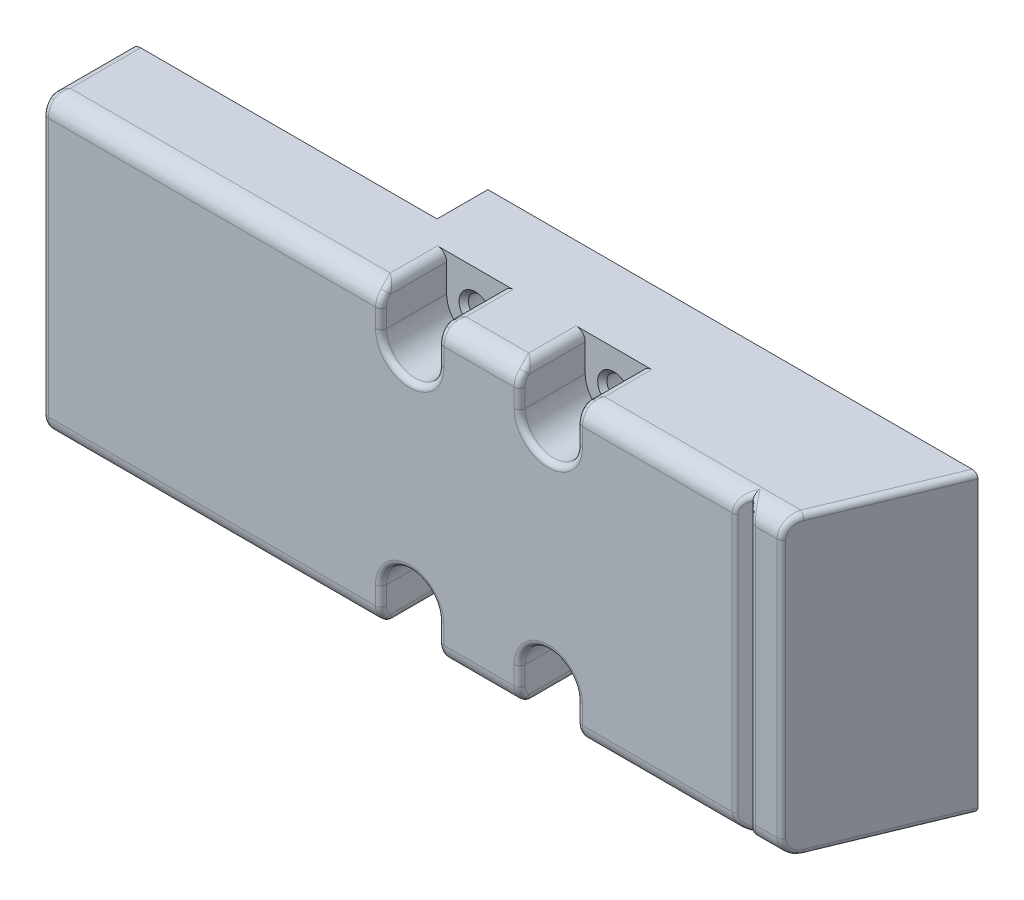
SolidWorks part; units mm, degrees
ref_plane "Front Plane" through (0, 0, 0) normal (0, 0, 1) x (1, 0, 0)
ref_plane "Top Plane" through (0, 0, 0) normal (0, 1, 0) x (1, 0, 0)
ref_plane "Right Plane" through (0, 0, 0) normal (1, 0, 0) x (0, 0, -1)
sketch "Sketch1" plane through (0, 0, 0) normal (0, 0, 1) x (1, 0, 0)
  line L0 (25.86, 8.5) -> (25.86, -8.5) construction
  line L3 (-49.73, -7.875) -> (-49.73, -11.225) construction
  line L4 (-42.14, 8.5) -> (25.86, 8.5) construction
  line L5 (25.86, 8.5) -> (25.86, -8.5) construction
  line L18 (25.86, -8.5) -> (-42.14, -8.5) construction
  line L19 (-42.14, 8.5) -> (25.86, 8.5) construction
  line L20 (25.86, 8.5) -> (25.86, -8.5) construction
  line L21 (25.86, -8.5) -> (-42.14, -8.5) construction
  line L22 (-49.72, 8.51) -> (25.87, 8.51)
  line L23 (25.87, 8.51) -> (25.87, -8.51)
  line L24 (25.87, -8.51) -> (-49.72, -8.51)
  line L25 (25.87, -8.51) -> (-42.14, -8.51) construction
  line L40 (-42.14, 8.51) -> (25.87, 8.51) construction
  line L41 (-49.72, 8.51) -> (-49.72, 16)
  line L127 (-33.5059, 0) -> (-3.7253, 0) construction
  line L134 (-49.72, -16) -> (28.36, -16)
  line L135 (-49.72, -16) -> (-49.72, -8.51)
  line L136 (-49.72, 16) -> (28.36, 16)
  line L137 (28.36, -16) -> (28.36, 16)
  line L138 (-49.72, -16) -> (28.36, 16) construction
  line L139 (-49.72, 16) -> (28.36, -16) construction
  point P6 (-10.68, 0)
extrude "Boss-Extrude1" add sketch "Sketch1" against normal up to surface (7.5 mm away)
sketch "Sketch3" plane through (0, 0, -7.6) normal (0, -1, 0) x (-1, 0, 0)
  line L0 (49.72, -0.1) -> (49.72, -7.6) construction
  line L1 (-28.36, -7.6) -> (49.72, -7.6)
  line L2 (-28.36, -7.6) -> (-28.36, -9.7)
  line L3 (-28.36, -9.7) -> (49.72, -9.7)
  line L4 (49.72, -7.6) -> (49.72, -9.7)
  dimension "D1" = 9.6
extrude "Boss-Extrude2" add sketch "Sketch3" against normal up to surface and the other way up to surface
sketch "Sketch8" plane through (0, 0, 2.1) normal (0, 0, 1) x (1, 0, 0)
  line L0 (-33.5059, 0) -> (-3.7253, 0) construction
  line L1 (28.36, -16) -> (-14.5, -16)
  line L2 (28.36, -16) -> (28.36, -16.5)
  line L3 (28.36, -16.5) -> (-14.5, -16.5)
  line L4 (-14.5, -16) -> (-14.5, -16.5)
  line L5 (-10, 12) -> (5, 12) construction
  line L6 (-10, 12) -> (-10, -12) construction
  line L7 (-10, -12) -> (5, -12) construction
  line L8 (5, 12) -> (5, -12) construction
  line L9 (-10, 12) -> (5, -12) construction
  line L10 (-10, -12) -> (5, 12) construction
  line L11 (0, 0) -> (5, 0) construction
  line L12 (28.36, 16) -> (28.36, 16.5)
  line L13 (28.36, 16) -> (-14.5, 16)
  line L14 (-14.5, 16) -> (-14.5, 16.5)
  line L15 (28.36, 16.5) -> (-14.5, 16.5)
  circle A0 centre (5, -12) radius 2.5 construction
  circle A1 centre (5, -12) radius 1.25 construction
  circle A2 centre (-10, -12) radius 1.25 construction
  circle A3 centre (5, 12) radius 1.25 construction
  circle A4 centre (-10, 12) radius 1.25 construction
  point P5 (-2.5, 0)
  dimension "D2" = 5
  dimension "D7" = 2.5
  dimension "D1" = 24
  dimension "D3" = 5
  dimension "D4" = 15
  dimension "D5" = 4.5
  dimension "D6" = 4.5
sketch "Sketch9" plane through (0, 0, 2.1) normal (0, 0, 1) x (1, 0, 0)
  circle A0 centre (-10, -12) radius 1.25 construction
  circle A1 centre (5, -12) radius 1.25 construction
  circle A2 centre (-10, 12) radius 1.25 construction
  circle A3 centre (5, 12) radius 1.25 construction
  circle A4 centre (-10, -12) radius 1.25
  circle A5 centre (5, -12) radius 1.25
  circle A6 centre (-10, 12) radius 1.25
  circle A7 centre (5, 12) radius 1.25
extrude "Cut-Extrude4" cut sketch "Sketch9" against normal through all
sketch "Sketch10" plane through (0, 0, -7.5) normal (0, 0, -1) x (-1, 0, 0)
  line L0 (-28.36, -16) -> (-28.36, 16) construction
  line L1 (-28.36, -16) -> (16.64, -16)
  line L2 (-28.36, -16) -> (-28.36, 16)
  line L3 (-28.36, 16) -> (16.64, 16)
  line L4 (16.64, -16) -> (16.64, -8.51)
  line L5 (-25.87, -8.51) -> (-25.87, 8.51) construction
  line L7 (-25.87, -8.51) -> (-25.87, 8.51)
  line L8 (16.64, -8.51) -> (-25.87, -8.51)
  line L10 (-25.87, 8.51) -> (16.64, 8.51)
  line L11 (16.64, 8.51) -> (16.64, 16)
  line L12 (49.72, -16) -> (-28.36, -16) construction
  line L13 (-28.36, 16) -> (49.72, 16) construction
  line L14 (-25.87, 8.51) -> (49.72, 8.51) construction
  line L15 (49.72, -8.51) -> (-25.87, -8.51) construction
  circle A1 centre (10, 12) radius 1.25 construction
  circle A2 centre (-5, 12) radius 1.25 construction
  circle A3 centre (10, -12) radius 1.25 construction
  circle A4 centre (-5, -12) radius 1.25 construction
  circle A5 centre (10, 12) radius 1.25
  circle A6 centre (-5, 12) radius 1.25
  circle A7 centre (10, -12) radius 1.25
  circle A8 centre (-5, -12) radius 1.25
  dimension "D1" = 45
extrude "Boss-Extrude4" add sketch "Sketch10" along normal offset from surface (5.5 mm away) 5.5
ref_plane "Plane1" through (0, 0, -15.5) normal (0, 0, -1) x (-1, 0, 0)
sketch "Sketch25" plane through (0, 16, 0) normal (0, 1, 0) x (1, 0, 0)
  line L0 (28.36, 13) -> (36.4146, 13)
  line L1 (36.4146, 13) -> (30.16, -2.1)
  line L2 (30.16, -2.1) -> (28.36, -2.1)
  line L4 (28.36, 13) -> (28.36, -2.1) construction
  line L5 (28.36, 13) -> (28.36, -2.1)
  dimension "D1" = 1.8
  dimension "D2" = 22.5
extrude "Boss-Extrude5" add sketch "Sketch25" against normal up to surface (32 mm away)
fillet "Fillet13" radius 2 2 edges at (-9.78, -16, 2.1) (-9.78, 16, 2.1)
sketch "Sketch11" plane through (0, 0, 2.1) normal (0, 0, 1) x (1, 0, 0)
  circle A0 centre (5, -12) radius 3.1
  circle A1 centre (-10, -12) radius 3.1
  circle A2 centre (5, 12) radius 3.1
  circle A3 centre (-10, 12) radius 3.1
  dimension "D1" = 6.2
extrude "Cut-Extrude5" cut sketch "Sketch11" against normal offset from surface (7.1 mm away) 10.5
sketch "Sketch16" plane through (0, 0, 2.1) normal (0, 0, 1) x (1, 0, 0)
  line L0 (-10, 12) -> (-6.9, 12) construction
  line L1 (-13.1, 12) -> (-6.9, 12)
  line L2 (-13.1, 12) -> (-13.1, 22)
  line L3 (-13.1, 22) -> (-6.9, 22)
  line L4 (-6.9, 12) -> (-6.9, 22)
  line L5 (1.9, 12) -> (8.1, 12)
  line L6 (1.9, 12) -> (1.9, 22)
  line L7 (1.9, 22) -> (8.1, 22)
  line L8 (8.1, 12) -> (8.1, 22)
  line L9 (-13.1, -12) -> (-6.9, -12)
  line L10 (-13.1, -12) -> (-13.1, -22)
  line L11 (-13.1, -22) -> (-6.9, -22)
  line L12 (-6.9, -12) -> (-6.9, -22)
  line L13 (1.9, -12) -> (8.1, -12)
  line L14 (1.9, -12) -> (1.9, -22)
  line L15 (1.9, -22) -> (8.1, -22)
  line L16 (8.1, -12) -> (8.1, -22)
  line L17 (-10, -12) -> (-6.9, -12) construction
  circle A0 centre (-10, 12) radius 3.1 construction
  circle A1 centre (-10, 12) radius 3.1 construction
  circle A2 centre (5, 12) radius 3.1 construction
  circle A3 centre (-10, -12) radius 3.1 construction
  circle A4 centre (-10, -12) radius 3.1 construction
  circle A8 centre (5, 12) radius 3.1 construction
  circle A9 centre (5, 12) radius 3.1 construction
  circle A11 centre (5, -12) radius 3.1 construction
  circle A12 centre (5, -12) radius 3.1 construction
  point P12 (1.9, 12)
  point P13 (8.1, 12)
  point P29 (8.1, -12)
  point P37 (1.9, -12)
  dimension "D1" = 10
extrude "Cut-Extrude8" cut sketch "Sketch16" against normal up to surface (7.1 mm away)
sketch "Sketch17" plane through (0, 0, -13) normal (0, 0, -1) x (-1, 0, 0)
  line L0 (16.64, -8.51) -> (16.64, 8.51)
  line L9 (-36.4146, 16) -> (-36.4146, -16)
  line L10 (-36.4146, 16) -> (-36.4146, -16)
  line L13 (-25.87, 8.51) -> (16.64, 8.51)
  line L14 (16.64, 8.51) -> (16.64, 16)
  line L15 (16.64, 16) -> (-36.4146, 16)
  line L17 (-36.4146, -16) -> (16.64, -16)
  line L18 (16.64, -16) -> (16.64, -8.51)
  line L19 (16.64, -8.51) -> (-25.87, -8.51)
  line L22 (-25.87, -8.51) -> (-25.87, 8.51)
  line L26 (16.64, 8.51) -> (16.64, 16)
  line L27 (16.64, 16) -> (-36.4146, 16)
  line L29 (-36.4146, -16) -> (16.64, -16)
  line L30 (16.64, -16) -> (16.64, -8.51)
  dimension "D1" = 0
fillet "Fillet10" radius 1 10 edges at (-13.1, -16, -2.45) (-6.9, -16, -2.45) (1.9, -16, -2.45) (8.1, -16, -2.45) (-13.1, 16, -2.45) (-6.9, 16, -2.45) (1.9, 16, -2.45) (8.1, 16, -2.45) (-49.72, 16, -3.7) (-49.72, -16, -3.7)
sketch "Sketch20" plane through (0, 0, -7.5) normal (0, 0, -1) x (-1, 0, 0)
  line L0 (16.64, -16) -> (48.72, -16) construction
  line L1 (32, -13) -> (45.72, -13) construction
  line L2 (32, -13) -> (32, 13) construction
  line L3 (32, 13) -> (45.72, 13) construction
  line L4 (45.72, -13) -> (45.72, 13) construction
  line L5 (48.72, 16) -> (16.64, 16) construction
  line L7 (49.72, 8.51) -> (49.72, 15) construction
  circle A0 centre (32, 13) radius 1.5
  circle A1 centre (32, -13) radius 1.5
  circle A2 centre (45.72, -13) radius 1.5
  circle A3 centre (45.72, 13) radius 1.5
extrude "Cut-Extrude9" cut sketch "Sketch20" against normal blind 3
chamfer "Chamfer1" distance 0.3 angle 45 4 edges at (-47.22, 13, -7.5) (-47.22, -13, -7.5) (-33.5, 13, -7.5) (-33.5, -13, -7.5)
sketch "Sketch21" plane through (0, 0, 0) normal (0, 0, -1) x (-1, 0, 0)
  line L0 (49.72, 8.51) -> (49.72, -8.51) construction
  line L8 (49.72, -8.51) -> (49.72, 8.51)
  line L9 (40.72, -8.51) -> (49.72, -8.51)
  line L11 (49.72, 8.51) -> (40.72, 8.51)
  line L16 (49.72, 8.51) -> (-25.87, 8.51) construction
  line L17 (-25.87, -8.51) -> (49.72, -8.51) construction
  line L30 (40.72, 8.51) -> (40.72, -8.51)
  dimension "D2" = 9
extrude "Cut-Extrude10" cut sketch "Sketch21" against normal blind 0.3
chamfer "Chamfer2" distance 4.8 distance2 2 3 edges at (4.615, -8.51, -13) (25.87, 0, -13) (4.615, 8.51, -13)
fillet "Fillet12" [suppressed] radius 4
sketch "Sketch26" plane through (0, 0, 0) normal (0, 1, 0) x (1, 0, 0)
  line L0 (25.16, -2.1) -> (26.16, -1.1)
  line L1 (30.16, -2.1) -> (8.1, -2.1) construction
  line L2 (26.16, -1.1) -> (27.16, -2.1)
  line L3 (27.16, -2.1) -> (25.16, -2.1)
  line L4 (26.16, -2.1) -> (26.16, -1.1) construction
  dimension "D1" = 1
  dimension "D2" = 2
  dimension "D3" = 3
extrude "Cut-Extrude12" cut sketch "Sketch26" against normal through all both and the other way through all
sketch "Sketch28" plane through (0, 0, 0) normal (0, 0, -1) x (-1, 0, 0)
  line L0 (40.72, 8.51) -> (-25.87, 8.51) construction
  line L1 (-25.87, 8.51) -> (-25.87, -8.51) construction
  line L2 (-25.87, -8.51) -> (40.72, -8.51) construction
  line L3 (40.72, 8.51) -> (-25.87, 8.51)
  line L4 (-25.87, 8.51) -> (-25.87, -8.51)
  line L5 (-25.87, -8.51) -> (40.72, -8.51)
sketch "Sketch29" plane through (-40.72, 0, 0) normal (-1, 0, 0) x (0, 0, 1)
  line L0 (0, -8.51) -> (-1, -8.51)
  line L1 (-1, -8.51) -> (0, -9.01)
  line L2 (0, -9.01) -> (0, -8.51)
  line L3 (0, 8.51) -> (0, -8.51) construction
  dimension "D1" = 0.5
  dimension "D2" = 1
sweep "Cut-Sweep1" [suppressed] cut profiles "Sketch29" path "Sketch28"
chamfer "Chamfer3" distance 0.3 angle 45 1 edges at (-40.72, 0, 0.3)
sketch "Sketch27" plane through (-49.72, 0, 0) normal (-1, 0, 0) x (0, 0, 1)
  line L12 (0.3, -8.51) -> (0.3, 8.51) construction
  line L17 (-7.5, -8.51) -> (0.3, -8.51)
  line L18 (-7.5, -8.51) -> (-7.5, -7.91)
  line L19 (-7.5, -7.91) -> (0.3, -7.91)
  line L20 (0.3, -8.51) -> (0.3, -7.91)
  line L22 (0.3, 8.51) -> (-7.5, 8.51)
  line L23 (0.3, 8.51) -> (0.3, 7.91)
  line L24 (0.3, 7.91) -> (-7.5, 7.91)
  line L25 (-7.5, 8.51) -> (-7.5, 7.91)
  dimension "D1" = 0.6
extrude "Boss-Extrude6" add sketch "Sketch27" against normal blind 7
fillet "Fillet14" radius 1 2 edges at (-49.72, 7.91, -3.6) (-49.72, -7.91, -3.6)
chamfer "Chamfer5" distance 0.6 angle 45 2 edges at (-42.72, 8.51, -3.6) (-42.72, -8.51, -3.6)
chamfer "Chamfer4" distance 0.5 angle 45 8 edges at (3.75, -12, -5) (-11.25, -12, -5) (-11.25, 12, -5) (3.75, 12, -5) (-11.25, 12, -13) (3.75, 12, -13) (-11.25, -12, -13) (3.75, -12, -13)
fillet "Fillet15" radius 0.6 44 edges at (33.7015, -16, -6.45) (30.4026, -15.4142, 1.5142) (33.7015, 16, -6.45) (30.4026, 15.4142, 1.5142) (30.16, 0, 2.1) (-49.3926, 15.74, 1.0861) (-49.72, 14.5176, 2.0319) (-49.3926, -15.74, 1.0861) (-49.72, -14.5176, 2.0319) (-13.4274, 15.74, 1.0861) (-13.1, 14.5176, 2.0319) (-13.1, 13, 2.1) (-10, 8.9, 2.1) (-6.5726, 15.74, 1.0861) (-6.9, 14.5176, 2.0319) (-6.5726, -15.74, 1.0861) (-6.9, -14.5176, 2.0319) (-13.4274, -15.74, 1.0861) (-13.1, -14.5176, 2.0319) (-13.1, -13, 2.1) (-10, -8.9, 2.1) (8.4274, -15.74, 1.0861) (8.1, -14.5176, 2.0319) (8.1, -13, 2.1) (1.5726, -15.74, 1.0861) (1.9, -14.5176, 2.0319) (1.9, -13, 2.1) (1.5726, 15.74, 1.0861) (1.9, 14.5176, 2.0319) (1.9, 13, 2.1) (5, 8.9, 2.1) (8.4274, 15.74, 1.0861) (8.1, 14.5176, 2.0319) (25.4279, 15, 1.8321) (25.4279, -15, 1.8321) (26.8921, -15, 1.8321) (26.8921, 15, 1.8321) (-49.72, 0, 2.1) (-6.9, 13, 2.1) (-6.9, -13, 2.1) (5, -8.9, 2.1) (8.1, 13, 2.1) (25.16, 0, 2.1) (27.16, 0, 2.1)
fillet "Fillet16" radius 10 3 edges at (4.615, -8.51, -8.2) (4.615, 8.51, -8.2) (25.87, 0, -8.2)
sketch "Sketch31" plane through (26.4856, 0, 10.9707) normal (0.9239, 0, 0.3827) x (0.3827, 0, -0.9239)
  line L0 (15.0025, 15.4) -> (15.0025, -15.4) construction
  line L1 (25.9457, 15.4) -> (11.5178, 15.4) construction
  line L2 (11.5178, -15.4) -> (25.9457, -15.4) construction
  line L3 (10.0025, 14) -> (10.0025, -14) construction
  text T0 "DACTILE" font "Impact" height 6
  dimension "D1" = 5
extrude "Cut-Extrude13" [suppressed] cut sketch "Sketch31" against normal blind 0.5
equation "\"D2@Sketch1\"=\"D1@Sketch1\""
equation "\"D3@Sketch20\"=\"D2@Sketch20\""
